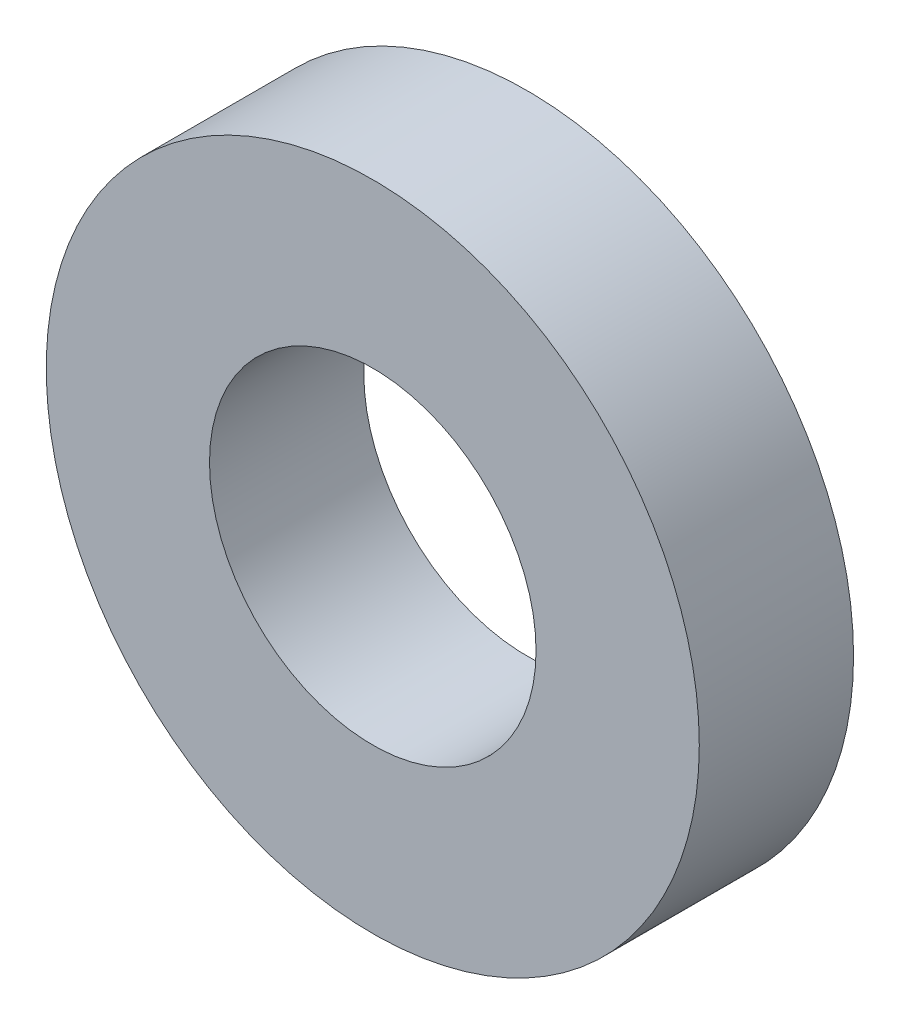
SolidWorks part; units mm, degrees
ref_plane "Front Plane" through (0, 0, 0) normal (0, 0, 1) x (1, 0, 0)
ref_plane "Top Plane" through (0, 0, 0) normal (0, 1, 0) x (1, 0, 0)
ref_plane "Right Plane" through (0, 0, 0) normal (1, 0, 0) x (0, 0, -1)
sketch "Sketch1" plane through (0, 0, 0) normal (0, 0, 1) x (1, 0, 0)
  circle A0 centre (0, 0) radius 3.175
  circle A1 centre (0, 0) radius 6.35
  dimension "D1" = 6.35
  dimension "D2" = 12.7
extrude "Boss-Extrude1" add sketch "Sketch1" along normal blind 3
